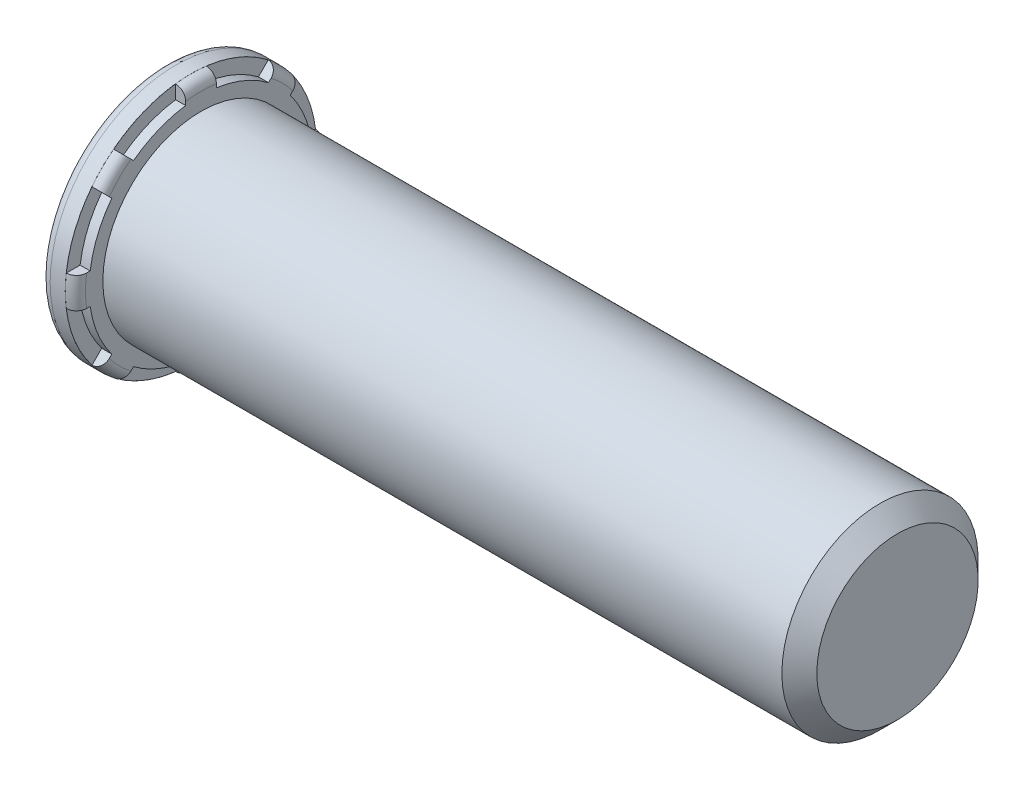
SolidWorks part; units mm, degrees
ref_plane "Plane1" through (0, 0, 0) normal (0, 0, 1) x (1, 0, 0)
ref_plane "Plane2" through (0, 0, 0) normal (0, 1, 0) x (1, 0, 0)
ref_plane "Plane3" through (0, 0, 0) normal (1, 0, 0) x (0, 0, -1)
sketch "BodySke" plane through (0, 0, 0) normal (0, 0, 1) x (1, 0, 0)
  line L0 (-0.64, 2.944) -> (-0.64, 0)
  line L1 (0.2585, 2.9415) -> (0.2585, 2.5)
  line L3 (0.2585, 2.5) -> (17.555, 2.5)
  line L4 (18, 2.055) -> (18, 0)
  line L5 (18, 0) -> (-0.64, 0)
  line L6 (0, 0) -> (50.554, 0) construction
  line L8 (18, 2.055) -> (17.555, 2.5)
  line L9 (-0.384, 3.2) -> (0, 3.2)
  line L10 (0.0025, 3.1975) -> (0, 3.1975)
  line L11 (0.8, 19.05) -> (0.8, -3.175) construction
  line L12 (0, 3.1975) -> (0, 3.2)
  arc A0 (-0.64, 2.944) -> (-0.384, 3.2) centre (-0.384, 2.944) cw
  arc A1 (0.0025, 3.1975) -> (0.2585, 2.9415) centre (0.0025, 2.9415) cw
  dimension "D2" = 0.0025
  dimension "Fillet_rad" = 0.256
  dimension "Diameter" = 5
  dimension "D3" = 0.0025
  dimension "Length" = 18
  dimension "Body_ch_ang" = 45
  dimension "Minor_dia" = 4.11
  dimension "Advance" = 0.8
  dimension "H_dia" = 6.4
  dimension "T_dim" = 0.64
revolve "BaseBody" add sketch "BodySke" angle 360 about L6
sketch "ThdSchSke" plane through (0, 0, 0) normal (0, 0, 1) x (1, 0, 0)
  line L0 (2.3, -2.055) -> (1.9884, -2.5)
  line L1 (2.3, -2.055) -> (2.6116, -2.5)
  line L2 (2.6116, -2.5) -> (2.6116, -3.125)
  line L3 (-3.175, 0) -> (5.1513, 0) construction
  line L4 (0, -3.2) -> (0, 3.2) construction
  line L5 (2.6116, -3.125) -> (1.9884, -3.125)
  line L6 (1.9884, -3.125) -> (1.9884, -2.5)
  dimension "Thread_minor" = 4.11
  dimension "Diameter" = 5
  dimension "Start" = 2.3
  dimension "SideAngle" = 55
  dimension "VeeAngle" = 70
  dimension "Overcut" = 6.25
revolve "ThreadSchematic" [suppressed] cut sketch "ThdSchSke" angle 360 about L3
pattern_linear "ThdSchPat" [suppressed]
sketch "RibCutSke" plane through (0.2585, 1.7944, -0.091) normal (1, 0, 0) x (0, 0, -1)
  line L0 (0.3001, 1.0286) -> (0.3001, 1.3816)
  line L1 (1.6287, 0.4783) -> (1.8783, 0.7279)
  line L2 (0.3001, 0.6748) -> (0.3001, 2.4006) construction
  line L3 (-0.091, -1.7944) -> (-0.091, 5.0239) construction
  line L4 (-0.091, -1.7944) -> (0.3001, 0.6748) construction
  line L5 (-0.091, -1.7944) -> (1.3785, 0.2281) construction
  line L6 (1.3785, 0.2281) -> (2.6039, 1.4535) construction
  circle A0 centre (-0.091, -1.7944) radius 2.9415 construction
  arc A1 (1.6287, 0.4783) -> (0.3001, 1.0286) centre (-0.091, -1.7944) ccw
  arc A2 (1.8783, 0.7279) -> (0.3001, 1.3816) centre (-0.091, -1.7944) ccw
  circle A4 centre (-0.091, -1.7944) radius 2.5 construction
  dimension "Inner_dia" = 5.7
  dimension "Outer_dia" = 6.4
  dimension "Rib_root_dia" = 5
  dimension "Rib_root_half_angle" = 9
  dimension "Rib_root_gap_angle" = 27
  dimension "Angle" = 45
extrude "RibCut" cut sketch "RibCutSke" against normal blind 0.2561
pattern_circular "RibCutsPat" count 8 every 45 about axis through (0, 0, 0) along (1, 0, 0) of "RibCut"
equation "' \"Length@BodySke\" = 18"
equation "' \"H_dia@BodySke\" = 6.4"
equation "' \"Start@ThdSchSke\" = 2.3"
equation "' \"T_dim@BodySke\" = 0.64"
equation "' \"Diameter@BodySke\" = 5"
equation "' \"Minor_dia@BodySke\" = 4.11"
equation "' \"Advance@BodySke\" = 0.8"
equation "\"Fillet_rad@BodySke\" =  \"T_dim@BodySke\" * 0.4"
equation "\"Num_ribs@RibCutsPat\" = 8"
equation "\"Angle@RibCutSke\" =\"Angle@RibCutsPat\""
equation "\"Rib_root_half_angle@RibCutSke\" = \"Angle@RibCutSke\" / 5"
equation "\"Rib_root_gap_angle@RibCutSke\" = \"Angle@RibCutSke\" - (2 * \"Rib_root_half_angle@RibCutSke\" )"
equation "\"Rib_root_dia@RibCutSke\" = \"Diameter@BodySke\""
equation "\"Inner_dia@RibCutSke\" = ( \"H_dia@BodySke\" + \"Diameter@BodySke\" ) / 2"
equation "\"Outer_dia@RibCutSke\" = \"H_dia@BodySke\""
equation "\"Depth@RibCut\" =  \"Fillet_rad@BodySke\" + 0.0001"
equation "\"Thread_length@ThreadCosmetic\" = \"Length@BodySke\" - \"Start@ThdSchSke\""
equation "\"Thread_minor@ThreadCosmetic\" = \"Minor_dia@BodySke\""
equation "\"Thread_minor@ThdSchSke\" = \"Minor_dia@BodySke\""
equation "\"Diameter@ThdSchSke\" = \"Diameter@BodySke\""
equation "\"Overcut@ThdSchSke\" = \"Diameter@BodySke\" * 1.25"
equation "\"Num_threads@ThdSchPat\" = int( \"Thread_length@ThreadCosmetic\" / \"Advance@BodySke\" + 0.999 )  + 1"
equation "\"Advance@ThdSchPat\" = \"Thread_length@ThreadCosmetic\" /  (\"Num_threads@ThdSchPat\" - 1) 'relax it"
equation "\"Num_threads@ThdSchPat\" = \"Num_threads@ThdSchPat\" - sgn( \"Num_threads@ThdSchPat\" - 1) '---chamfered tips only---"
